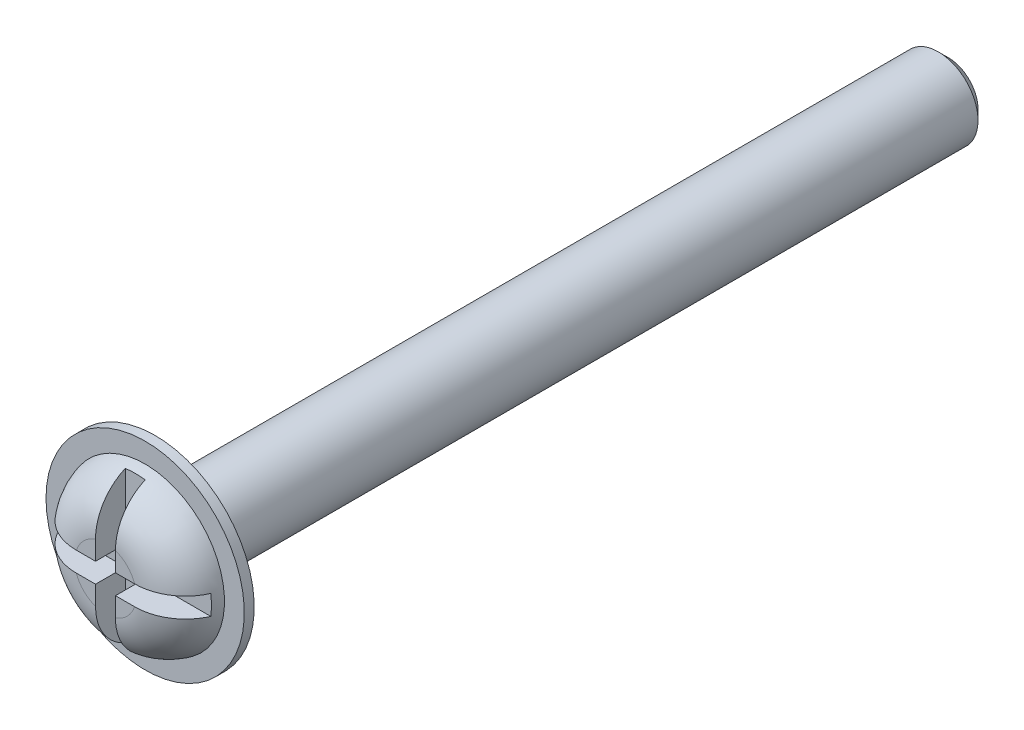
SolidWorks part; units mm, degrees
ref_plane "Плоскость1" through (0, 0, 0) normal (0, 0, 1) x (1, 0, 0)
ref_plane "Плоскость2" through (0, 0, 0) normal (0, 1, 0) x (1, 0, 0)
ref_plane "Плоскость3" through (0, 0, 0) normal (1, 0, 0) x (0, 0, -1)
sketch "Эскиз1" plane through (0, 0, 0) normal (0, 0, 1) x (1, 0, 0)
  circle A0 centre (0, 0) radius 4
  dimension "D1" = 8
extrude "Основание-Вытянуть" add sketch "Эскиз1" along normal blind 81
sketch "Эскиз2" plane through (0, 0, 81) normal (0, 0, 1) x (1, 0, 0)
  circle A0 centre (0, 0) radius 8
  dimension "D1" = 16
extrude "Бобышка-Вытянуть1" add sketch "Эскиз2" along normal blind 4
fillet "Скругление1" radius 5 1 edges at (8, 0, 85)
chamfer "Фаска1" distance 1 angle 45 1 edges at (4, 0, 0)
sketch "Эскиз3" plane through (0, 0, 85) normal (0, 0, 1) x (1, 0, 0)
  line L0 (0, 0) -> (0, 44.3713) construction
  line L1 (1.0048, 1) -> (10.0296, 1)
  line L2 (-10.0296, 1) -> (-1.0048, 1)
  line L3 (-10.0296, -1) -> (-1.0048, -1)
  line L4 (10.0296, 1) -> (10.0296, -1)
  line L5 (-10.0296, 1) -> (-10.0296, -1)
  line L6 (-1.0048, 10.0249) -> (1.0048, 10.0249)
  line L7 (-1.0048, 10.0249) -> (-1.0048, 1)
  line L8 (-1.0048, -10.0249) -> (1.0048, -10.0249)
  line L9 (1.0048, 10.0249) -> (1.0048, 1)
  line L10 (1.0048, -1) -> (1.0048, -10.0249)
  line L11 (-1.0048, -1) -> (-1.0048, -10.0249)
  line L12 (1.0048, -1) -> (10.0296, -1)
  line L13 (0, -10.0249) -> (0, 10.0249) construction
  line L14 (10.0296, 0) -> (-10.0296, 0) construction
extrude "Вырез-Вытянуть1" cut sketch "Эскиз3" against normal blind 3
sketch "Эскиз4" plane through (0, 0, 81) normal (0, 0, -1) x (-1, 0, 0)
  circle A0 centre (0, 0) radius 10
  dimension "D1" = 20
extrude "Бобышка-Вытянуть2" add sketch "Эскиз4" along normal blind 1
